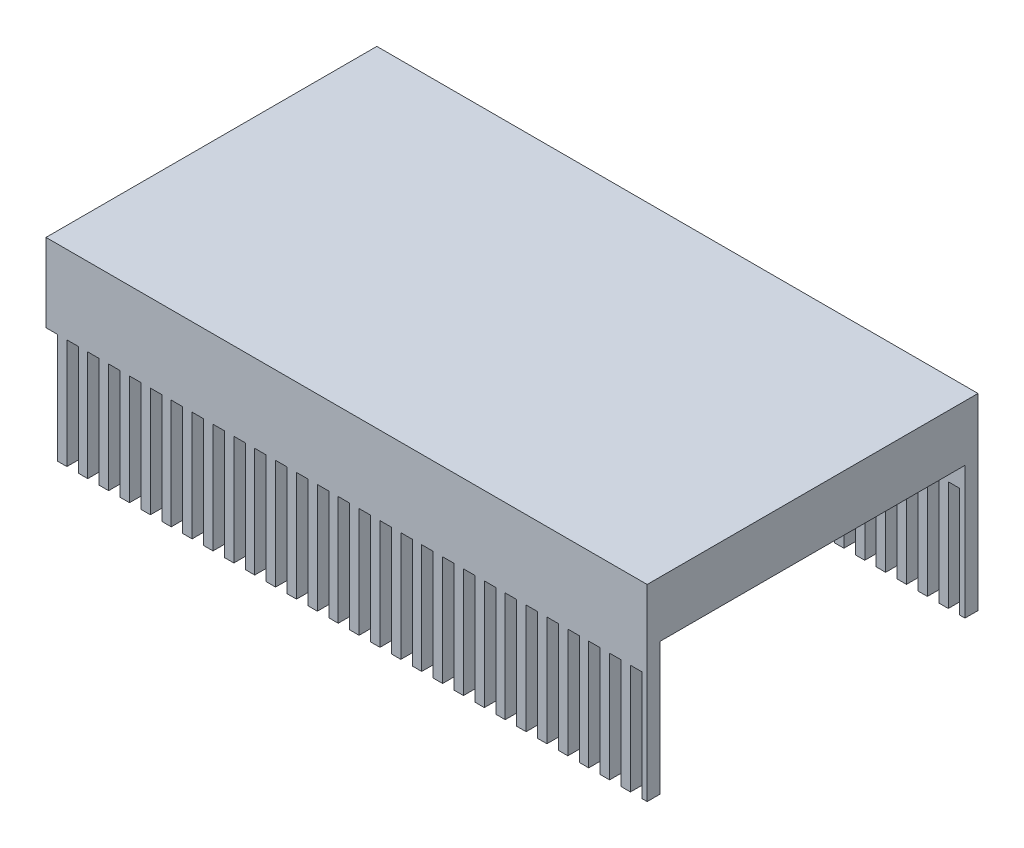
SolidWorks part; units mm, degrees
ref_plane "Front Plane" through (0, 0, 0) normal (0, 0, 1) x (1, 0, 0)
ref_plane "Top Plane" through (0, 0, 0) normal (0, 1, 0) x (1, 0, 0)
ref_plane "Right Plane" through (0, 0, 0) normal (1, 0, 0) x (0, 0, -1)
sketch "Sketch1" plane through (0, 0, 0) normal (0, 1, 0) x (1, 0, 0)
  line L1 (-18.288, -10.0648) -> (18.288, -10.0648)
  line L2 (-18.288, -10.0648) -> (-18.288, 10.0647)
  line L3 (-18.288, 10.0647) -> (18.288, 10.0647)
  line L4 (18.288, -10.0648) -> (18.288, 10.0647)
  line L5 (-18.288, -10.0648) -> (18.288, 10.0647) construction
  line L6 (-18.288, 10.0647) -> (18.288, -10.0648) construction
  point P0 (0, 0)
  dimension "D1" = 20.1295
  dimension "D2" = 36.576
extrude "Boss-Extrude1" add sketch "Sketch1" along normal blind 11.4427
sketch "Sketch2" plane through (18.288, 0, 0) normal (1, 0, 0) x (0, 0, -1)
  line L0 (-9.271, 0) -> (9.271, 0)
  line L1 (-10.0648, 0) -> (10.0647, 0) construction
  line L2 (-9.271, 0) -> (-9.271, 8.0518)
  line L3 (-10.0648, 11.4427) -> (10.0647, 11.4427) construction
  line L4 (-9.271, 8.0518) -> (9.271, 8.0518)
  line L5 (0, 6.2935) -> (0, -6.2935) construction
  line L6 (9.271, 0) -> (9.271, 8.0518)
  point P6 (0, 0)
  point P15 (0, 8.0518)
  dimension "D1" = 0.7937
  dimension "D2" = 3.3909
extrude "Cut-Extrude1" cut sketch "Sketch2" against normal through all
sketch "Sketch3" plane through (0, 0, 10.0648) normal (0, 0, 1) x (1, 0, 0)
  line L0 (-18.288, 0) -> (-18.288, 6.6802)
  line L1 (-18.288, 11.4427) -> (-18.288, 0) construction
  line L2 (-18.288, 6.6802) -> (-17.5899, 6.6802)
  line L3 (-17.5899, 6.6802) -> (-17.5899, 0)
  line L4 (-18.288, 0) -> (18.288, 0) construction
  line L5 (-17.5899, 0) -> (-18.288, 0)
  line L6 (-16.3199, 0) -> (-17.018, 0)
  line L7 (-17.018, 0) -> (-17.018, 6.6802)
  line L8 (-17.018, 6.6802) -> (-16.3199, 6.6802)
  line L9 (-16.3199, 6.6802) -> (-16.3199, 0)
  line L10 (-15.0499, 0) -> (-15.748, 0)
  line L11 (-15.748, 0) -> (-15.748, 6.6802)
  line L12 (-15.748, 6.6802) -> (-15.0499, 6.6802)
  line L13 (-15.0499, 6.6802) -> (-15.0499, 0)
  line L14 (-13.7799, 0) -> (-14.478, 0)
  line L15 (-14.478, 0) -> (-14.478, 6.6802)
  line L16 (-14.478, 6.6802) -> (-13.7799, 6.6802)
  line L17 (-13.7799, 6.6802) -> (-13.7799, 0)
  line L18 (-12.5099, 0) -> (-13.208, 0)
  line L19 (-13.208, 0) -> (-13.208, 6.6802)
  line L20 (-13.208, 6.6802) -> (-12.5099, 6.6802)
  line L21 (-12.5099, 6.6802) -> (-12.5099, 0)
  line L22 (-11.2399, 0) -> (-11.938, 0)
  line L23 (-11.938, 0) -> (-11.938, 6.6802)
  line L24 (-11.938, 6.6802) -> (-11.2399, 6.6802)
  line L25 (-11.2399, 6.6802) -> (-11.2399, 0)
  line L26 (-9.9699, 0) -> (-10.668, 0)
  line L27 (-10.668, 0) -> (-10.668, 6.6802)
  line L28 (-10.668, 6.6802) -> (-9.9699, 6.6802)
  line L29 (-9.9699, 6.6802) -> (-9.9699, 0)
  line L30 (-8.6999, 0) -> (-9.398, 0)
  line L31 (-9.398, 0) -> (-9.398, 6.6802)
  line L32 (-9.398, 6.6802) -> (-8.6999, 6.6802)
  line L33 (-8.6999, 6.6802) -> (-8.6999, 0)
  line L34 (-7.4299, 0) -> (-8.128, 0)
  line L35 (-8.128, 0) -> (-8.128, 6.6802)
  line L36 (-8.128, 6.6802) -> (-7.4299, 6.6802)
  line L37 (-7.4299, 6.6802) -> (-7.4299, 0)
  line L38 (-6.1599, 0) -> (-6.858, 0)
  line L39 (-6.858, 0) -> (-6.858, 6.6802)
  line L40 (-6.858, 6.6802) -> (-6.1599, 6.6802)
  line L41 (-6.1599, 6.6802) -> (-6.1599, 0)
  line L42 (-4.8899, 0) -> (-5.588, 0)
  line L43 (-5.588, 0) -> (-5.588, 6.6802)
  line L44 (-5.588, 6.6802) -> (-4.8899, 6.6802)
  line L45 (-4.8899, 6.6802) -> (-4.8899, 0)
  line L46 (-3.6199, 0) -> (-4.318, 0)
  line L47 (-4.318, 0) -> (-4.318, 6.6802)
  line L48 (-4.318, 6.6802) -> (-3.6199, 6.6802)
  line L49 (-3.6199, 6.6802) -> (-3.6199, 0)
  line L50 (-2.3499, 0) -> (-3.048, 0)
  line L51 (-3.048, 0) -> (-3.048, 6.6802)
  line L52 (-3.048, 6.6802) -> (-2.3499, 6.6802)
  line L53 (-2.3499, 6.6802) -> (-2.3499, 0)
  line L54 (-1.0799, 0) -> (-1.778, 0)
  line L55 (-1.778, 0) -> (-1.778, 6.6802)
  line L56 (-1.778, 6.6802) -> (-1.0799, 6.6802)
  line L57 (-1.0799, 6.6802) -> (-1.0799, 0)
  line L58 (0.1901, 0) -> (-0.508, 0)
  line L59 (-0.508, 0) -> (-0.508, 6.6802)
  line L60 (-0.508, 6.6802) -> (0.1901, 6.6802)
  line L61 (0.1901, 6.6802) -> (0.1901, 0)
  line L62 (1.4601, 0) -> (0.762, 0)
  line L63 (0.762, 0) -> (0.762, 6.6802)
  line L64 (0.762, 6.6802) -> (1.4601, 6.6802)
  line L65 (1.4601, 6.6802) -> (1.4601, 0)
  line L66 (2.7301, 0) -> (2.032, 0)
  line L67 (2.032, 0) -> (2.032, 6.6802)
  line L68 (2.032, 6.6802) -> (2.7301, 6.6802)
  line L69 (2.7301, 6.6802) -> (2.7301, 0)
  line L70 (4.0001, 0) -> (3.302, 0)
  line L71 (3.302, 0) -> (3.302, 6.6802)
  line L72 (3.302, 6.6802) -> (4.0001, 6.6802)
  line L73 (4.0001, 6.6802) -> (4.0001, 0)
  line L74 (5.2701, 0) -> (4.572, 0)
  line L75 (4.572, 0) -> (4.572, 6.6802)
  line L76 (4.572, 6.6802) -> (5.2701, 6.6802)
  line L77 (5.2701, 6.6802) -> (5.2701, 0)
  line L78 (6.5401, 0) -> (5.842, 0)
  line L79 (5.842, 0) -> (5.842, 6.6802)
  line L80 (5.842, 6.6802) -> (6.5401, 6.6802)
  line L81 (6.5401, 6.6802) -> (6.5401, 0)
  line L82 (7.8101, 0) -> (7.112, 0)
  line L83 (7.112, 0) -> (7.112, 6.6802)
  line L84 (7.112, 6.6802) -> (7.8101, 6.6802)
  line L85 (7.8101, 6.6802) -> (7.8101, 0)
  line L86 (9.0801, 0) -> (8.382, 0)
  line L87 (8.382, 0) -> (8.382, 6.6802)
  line L88 (8.382, 6.6802) -> (9.0801, 6.6802)
  line L89 (9.0801, 6.6802) -> (9.0801, 0)
  line L90 (10.3501, 0) -> (9.652, 0)
  line L91 (9.652, 0) -> (9.652, 6.6802)
  line L92 (9.652, 6.6802) -> (10.3501, 6.6802)
  line L93 (10.3501, 6.6802) -> (10.3501, 0)
  line L94 (11.6201, 0) -> (10.922, 0)
  line L95 (10.922, 0) -> (10.922, 6.6802)
  line L96 (10.922, 6.6802) -> (11.6201, 6.6802)
  line L97 (11.6201, 6.6802) -> (11.6201, 0)
  line L98 (12.8901, 0) -> (12.192, 0)
  line L99 (12.192, 0) -> (12.192, 6.6802)
  line L100 (12.192, 6.6802) -> (12.8901, 6.6802)
  line L101 (12.8901, 6.6802) -> (12.8901, 0)
  line L102 (14.1601, 0) -> (13.462, 0)
  line L103 (13.462, 0) -> (13.462, 6.6802)
  line L104 (13.462, 6.6802) -> (14.1601, 6.6802)
  line L105 (14.1601, 6.6802) -> (14.1601, 0)
  line L106 (15.4301, 0) -> (14.732, 0)
  line L107 (14.732, 0) -> (14.732, 6.6802)
  line L108 (14.732, 6.6802) -> (15.4301, 6.6802)
  line L109 (15.4301, 6.6802) -> (15.4301, 0)
  line L110 (16.7001, 0) -> (16.002, 0)
  line L111 (16.002, 0) -> (16.002, 6.6802)
  line L112 (16.002, 6.6802) -> (16.7001, 6.6802)
  line L113 (16.7001, 6.6802) -> (16.7001, 0)
  line L114 (17.9701, 0) -> (17.272, 0)
  line L115 (17.272, 0) -> (17.272, 6.6802)
  line L116 (17.272, 6.6802) -> (17.9701, 6.6802)
  line L117 (17.9701, 6.6802) -> (17.9701, 0)
  line L118 (19.2401, 0) -> (18.542, 0)
  line L119 (18.542, 0) -> (18.542, 6.6802)
  line L120 (18.542, 6.6802) -> (19.2401, 6.6802)
  line L121 (19.2401, 6.6802) -> (19.2401, 0)
  dimension "D1" = 4.7625
  dimension "D2" = 30
extrude "Cut-Extrude2" cut sketch "Sketch3" against normal through all
